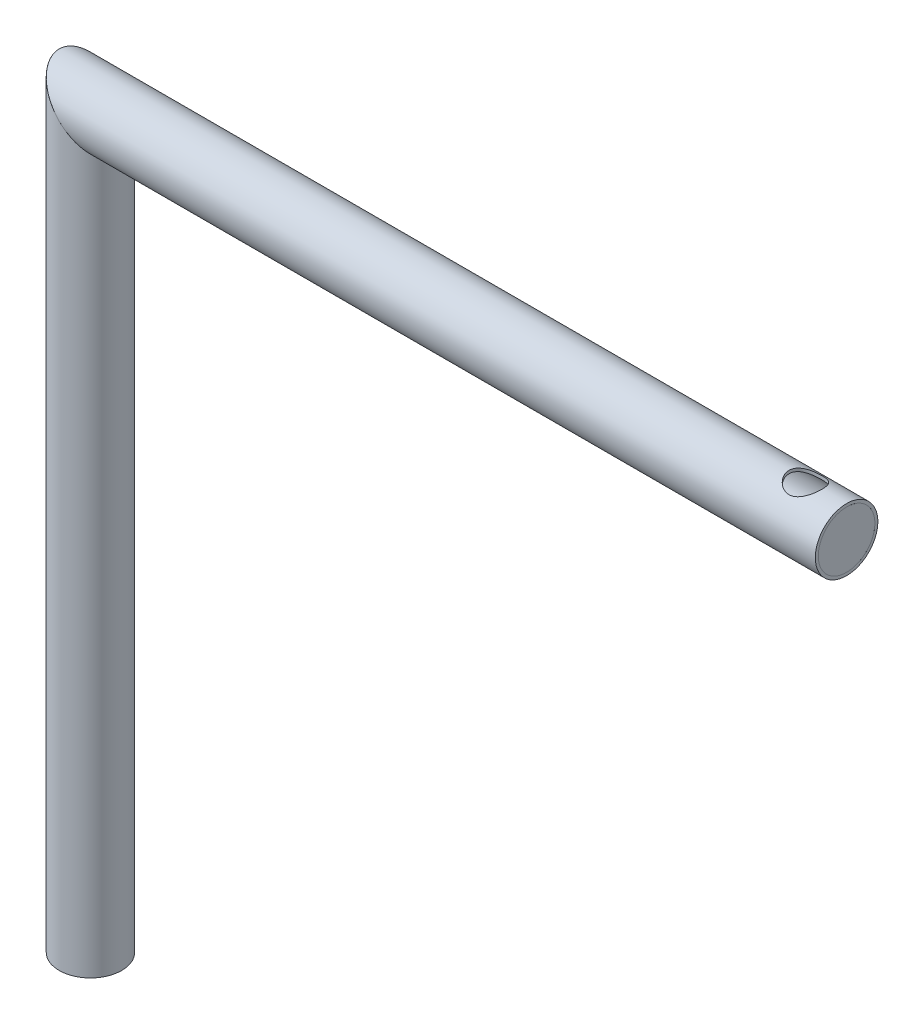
SolidWorks part; units mm, degrees
ref_plane "Y" through (0, 0, 0) normal (0, 0, 1) x (1, 0, 0)
ref_plane "Z" through (0, 0, 0) normal (0, 1, 0) x (1, 0, 0)
ref_plane "X" through (0, 0, 0) normal (1, 0, 0) x (0, 0, -1)
imported_body "Importiert1"
imported_body "Importiert2"
imported_body "Importiert3"
other "Fläche löschen1"
